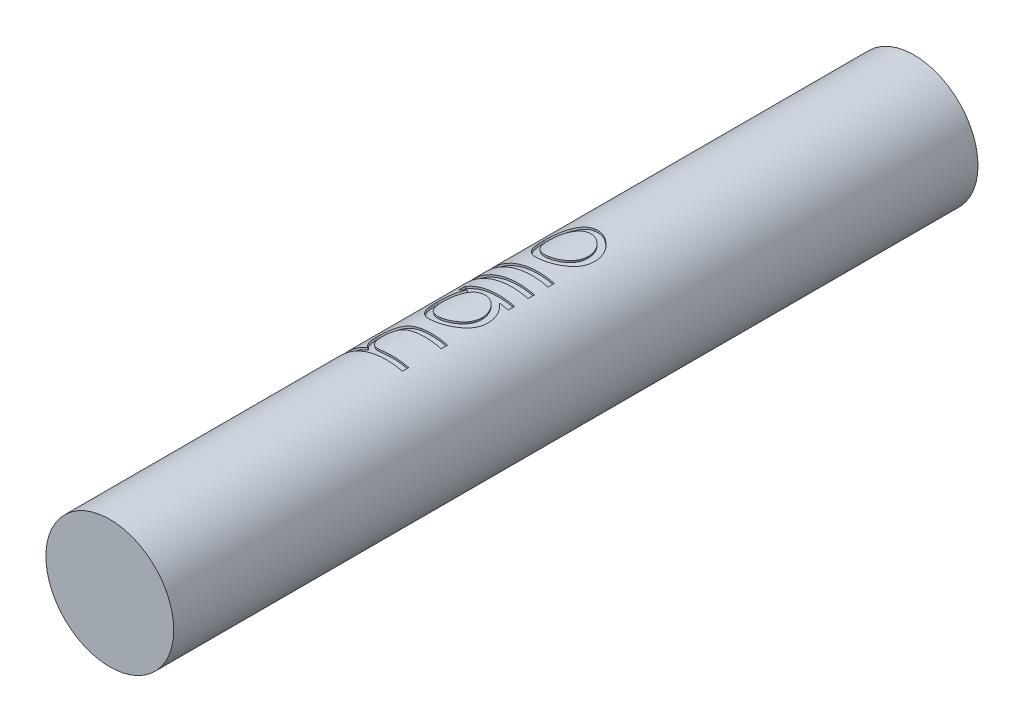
SolidWorks part; units mm, degrees
ref_plane "Vorne" through (0, 0, 0) normal (0, 0, 1) x (1, 0, 0)
ref_plane "Oben" through (0, 0, 0) normal (0, 1, 0) x (1, 0, 0)
ref_plane "Rechts" through (0, 0, 0) normal (1, 0, 0) x (0, 0, -1)
sketch "Skizze1" plane through (0, 0, 0) normal (0, 0, 1) x (1, 0, 0)
  circle A0 centre (0, 0) radius 17.2481
extrude "Linear austragen1" add sketch "Skizze1" along normal blind 217
sketch "Skizze2"
wrap "Umwickeln1" sketch "Skizze2" wrap type deboss source sketch "Skizze2" thickness 0.5 parameters "D1"=0.5
